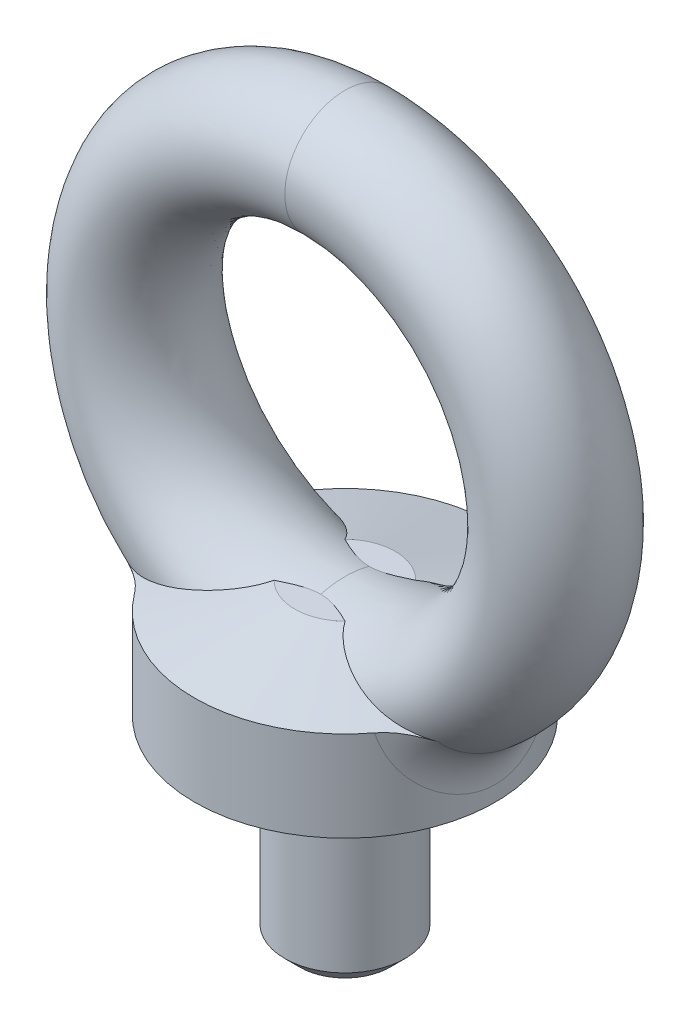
SolidWorks part; units mm, degrees
ref_plane "Front" through (0, 0, 0) normal (0, 0, 1) x (1, 0, 0)
ref_plane "Top" through (0, 0, 0) normal (0, 1, 0) x (1, 0, 0)
ref_plane "Right" through (0, 0, 0) normal (1, 0, 0) x (0, 0, -1)
other "Configuration Table"
sketch "Sketch1" plane through (0, 0, 0) normal (0, 0, 1) x (1, 0, 0)
  line L0 (0, 29.5419) -> (0, -28.9357) construction
  line L1 (-28.3559, -18) -> (21.4097, -18) construction
  arc A0 (0, -10) -> (0, 10) centre (0, 0) ccw
  arc A1 (0, -18) -> (0, 18) centre (0, 0) ccw
sketch "Sketch2" plane through (0, 0, 0) normal (1, 0, 0) x (0, 0, -1)
  circle A0 centre (0, 14) radius 4
  point P2 (0, 18)
  point P6 (0, 10)
sketch "Sketch3" plane through (0, 0, 0) normal (1, 0, 0) x (0, 0, -1)
  ellipse E0 centre (0, -14) end of major axis (-5, -14) minor radius 4
  dimension "m" = 10
loft "Loft1" add profiles "Sketch2", "Sketch3"
mirror "Mirror1" about plane through (0, 0, 0) normal (1, 0, 0)
sketch "Sketch4" plane through (0, 0, 0) normal (0, 0, 1) x (1, 0, 0)
  line L0 (10, -12) -> (10, -18)
  line L1 (-28.3559, -18) -> (21.4097, -18) construction
  line L2 (10, -12) -> (3.3333, -10.2137)
  line L3 (3.3333, -10.2137) -> (0, -10.2137)
  line L4 (0, 29.5419) -> (0, -28.9357) construction
  line L5 (3, -18) -> (3, -19.3453)
  line L6 (3.5, -20.2113) -> (4, -20.5)
  line L7 (4, -20.5) -> (4, -31)
  line L8 (4, -31) -> (0, -31)
  line L9 (0, -2.475) -> (0, -32.5334) construction
  line L10 (10, -18) -> (6, -18)
  line L11 (6, -18) -> (4.5, -17.134)
  line L12 (0, -10.2137) -> (0, -31)
  arc A0 (4.5, -17.134) -> (3, -18) centre (4, -18) ccw
  arc A3 (3, -19.3453) -> (3.5, -20.2113) centre (4, -19.3453) ccw
revolve "Revolve1" add sketch "Sketch4" angle 360 about L9
chamfer "Chamfer1" distance 1 angle 45 1 edges at (0, -31, 4)
fillet "Fillet1" radius 4 2 edges at (-9.9818, -14.9391, -0.6027) (9.9818, -14.9391, 0.6027)
sketch "Sketch5" plane through (0, 0, 0) normal (0, 0, 1) x (1, 0, 0)
  line L0 (0, 0) -> (0, -37.4241) construction
  line L1 (4, -20.2998) -> (5, -20.2998)
  line L2 (5, -20.2998) -> (5, -21.7002)
  line L3 (5, -21.7002) -> (4, -21.7002)
  line L4 (4, -21.7002) -> (3, -21)
  line L5 (3, -21) -> (4, -20.2998)
  line L6 (-6, -18) -> (6, -18) construction
revolve "ThreadSchematic" [suppressed] cut sketch "Sketch5" angle 360 about L0
pattern_linear "ThdSchPat" [suppressed] count 10 spacing 1 along (0, -1, 0)
equation "\"D8@Sketch4\" = \"D4@Sketch1\" / 3"
equation "\"D1@ThreadCosmetic\" = \"l@Sketch4\" - \"f@Sketch4\""
equation "\"D1@Sketch5\" = \"D2@ThreadCosmetic\""
equation "\"D5@Sketch5\" = \"f@Sketch4\" +  ( \"advance@Sketch5\" / 2.0 ) "
equation "\"D1@ThdSchPat\" = int (  (  ( \"l@Sketch4\" - \"f@Sketch4\" )  / \"advance@Sketch5\" )  + 0.0 ) "
